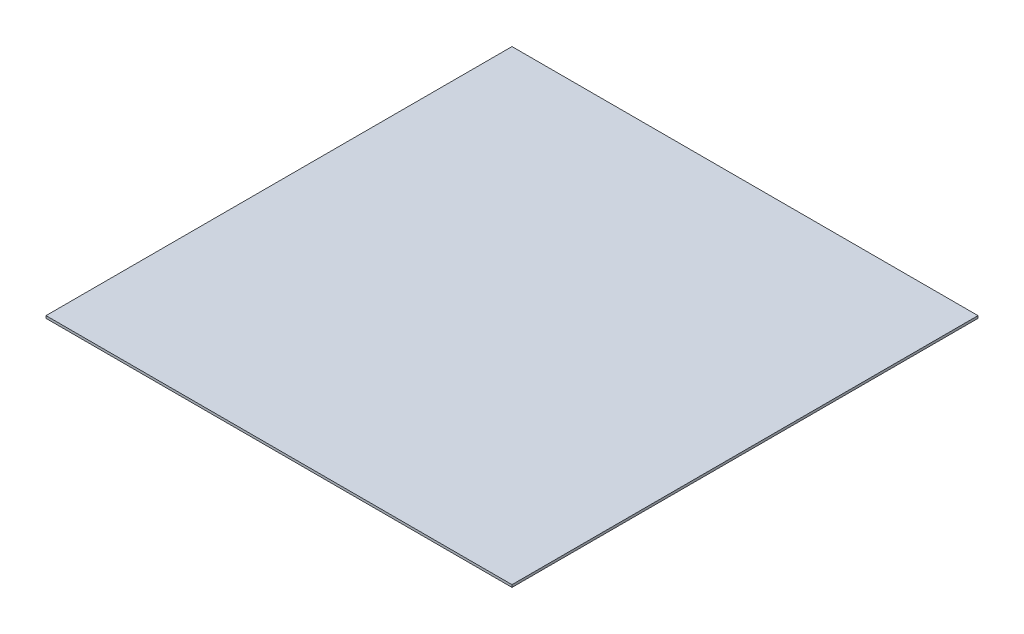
SolidWorks part; units mm, degrees
ref_plane "Front Plane" through (0, 0, 0) normal (0, 0, 1) x (1, 0, 0)
ref_plane "Top Plane" through (0, 0, 0) normal (0, 1, 0) x (1, 0, 0)
ref_plane "Right Plane" through (0, 0, 0) normal (1, 0, 0) x (0, 0, -1)
sketch "Sketch1" plane through (0, 0, 0) normal (0, 1, 0) x (1, 0, 0)
  line L1 (-609.6, 609.6) -> (609.6, 609.6)
  line L2 (-609.6, 609.6) -> (-609.6, -609.6)
  line L3 (-609.6, -609.6) -> (609.6, -609.6)
  line L4 (609.6, 609.6) -> (609.6, -609.6)
  line L5 (-609.6, 609.6) -> (609.6, -609.6) construction
  line L6 (-609.6, -609.6) -> (609.6, 609.6) construction
  point P0 (0, 0)
  dimension "D1" = 1219.2
extrude "Boss-Extrude1" add sketch "Sketch1" along normal blind 6.35
sketch "Sketch2" plane through (0, 6.35, 0) normal (0, 1, 0) x (1, 0, 0)
  line L1 (-127, 127) -> (127, 127)
  line L2 (-127, 127) -> (-127, -127)
  line L3 (-127, -127) -> (127, -127)
  line L4 (127, 127) -> (127, -127)
  line L5 (-127, 127) -> (127, -127) construction
  line L6 (-127, -127) -> (127, 127) construction
  point P0 (0, 0)
  dimension "D1" = 254
extrude "Cut-Extrude1" [suppressed] cut sketch "Sketch2" against normal through all
